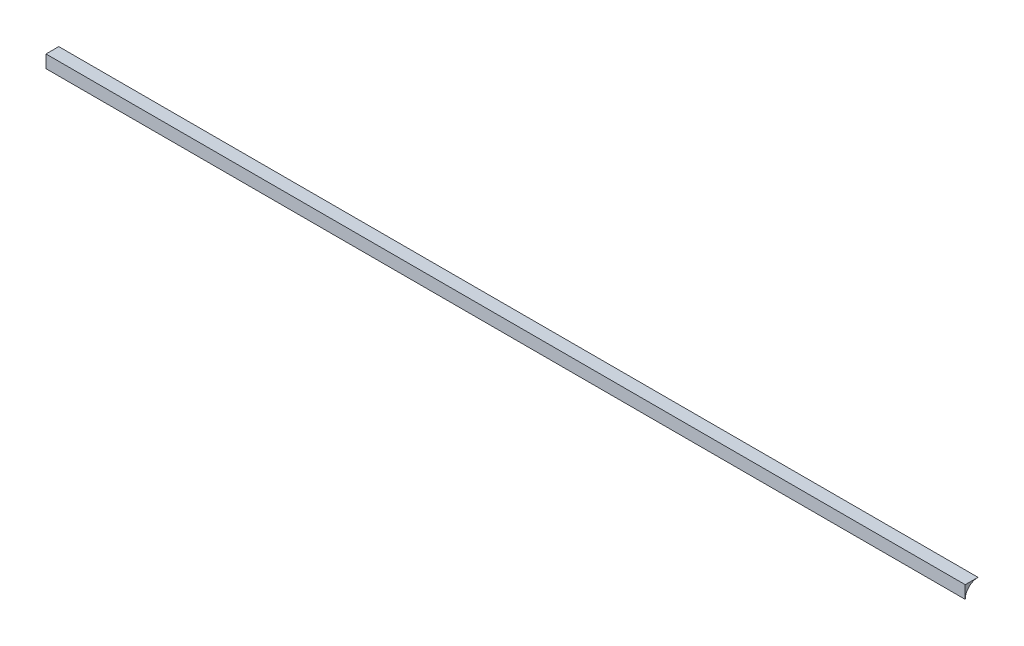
SolidWorks part; units mm, degrees
ref_plane "Front Plane" through (0, 0, 0) normal (1, 0, 0) x (0, 1, 0)
ref_plane "Top Plane" through (0, 0, 0) normal (0, 0, 1) x (0, 1, 0)
ref_plane "Right Plane" through (0, 0, 0) normal (0, 1, 0) x (-1, 0, 0)
sketch "Sketch1" plane through (0, 0, 0) normal (1, 0, 0) x (0, 1, 0)
  line L0 (76.2, 76.2) -> (73.025, 76.2)
  line L1 (73.025, 76.2) -> (73.6444, 76.139)
  line L2 (73.6444, 76.139) -> (74.24, 75.9583)
  line L3 (74.24, 75.9583) -> (74.7889, 75.6649)
  line L4 (74.7889, 75.6649) -> (75.2701, 75.2701)
  line L5 (75.2701, 75.2701) -> (75.6649, 74.7889)
  line L6 (75.6649, 74.7889) -> (75.9583, 74.24)
  line L7 (75.9583, 74.24) -> (76.139, 73.6444)
  line L8 (76.139, 73.6444) -> (76.2, 73.025)
  line L9 (76.2, 73.025) -> (76.2, 76.2)
ref_plane "Plane1" through (304.8, 0, 0) normal (1, 0, 0) x (0, 1, 0)
sketch "Sketch2" plane through (304.8, 0, 0) normal (1, 0, 0) x (0, 1, 0)
  line L0 (152.4, 152.4) -> (149.225, 152.4)
  line L1 (149.225, 152.4) -> (149.8444, 152.339)
  line L2 (149.8444, 152.339) -> (150.44, 152.1583)
  line L3 (150.44, 152.1583) -> (150.9889, 151.8649)
  line L4 (150.9889, 151.8649) -> (151.4701, 151.4701)
  line L5 (151.4701, 151.4701) -> (151.8649, 150.9889)
  line L6 (151.8649, 150.9889) -> (152.1583, 150.44)
  line L7 (152.1583, 150.44) -> (152.339, 149.8444)
  line L8 (152.339, 149.8444) -> (152.4, 149.225)
  line L9 (152.4, 149.225) -> (152.4, 152.4)
loft "Applied_tapered_corner_caulk" add profiles "Sketch1", "Sketch2"
